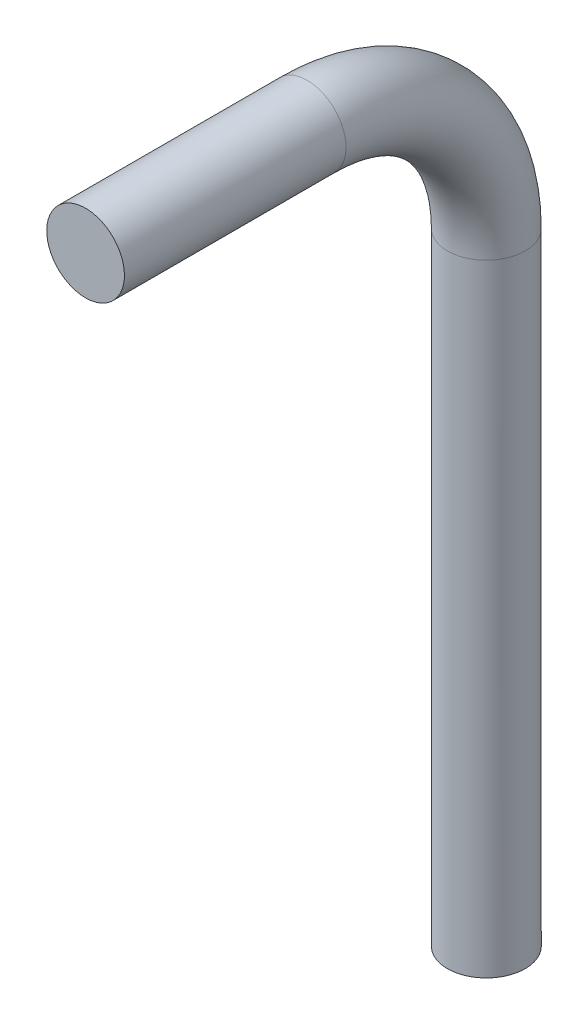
SolidWorks part; units mm, degrees
ref_plane "Front Plane" through (0, 0, 0) normal (0, 0, 1) x (1, 0, 0)
ref_plane "Top Plane" through (0, 0, 0) normal (0, 1, 0) x (1, 0, 0)
ref_plane "Right Plane" through (0, 0, 0) normal (1, 0, 0) x (0, 0, -1)
sketch "Sketch1" plane through (0, 0, 0) normal (0, 1, 0) x (1, 0, 0)
  circle A0 centre (0, 0) radius 25.4
  dimension "D1" = 50.8
sketch "Sketch2" plane through (0, 0, 0) normal (1, 0, 0) x (0, 0, -1)
  line L0 (0, 0) -> (0, 406.4)
  line L1 (-117.1212, 523.5212) -> (-261.9987, 523.5212)
  arc A0 (0, 406.4) -> (-117.1212, 523.5212) centre (-117.1212, 406.4) ccw
  dimension "D1" = 406.4
sweep "Sweep1" add profiles "Sketch1" path "Sketch2"
